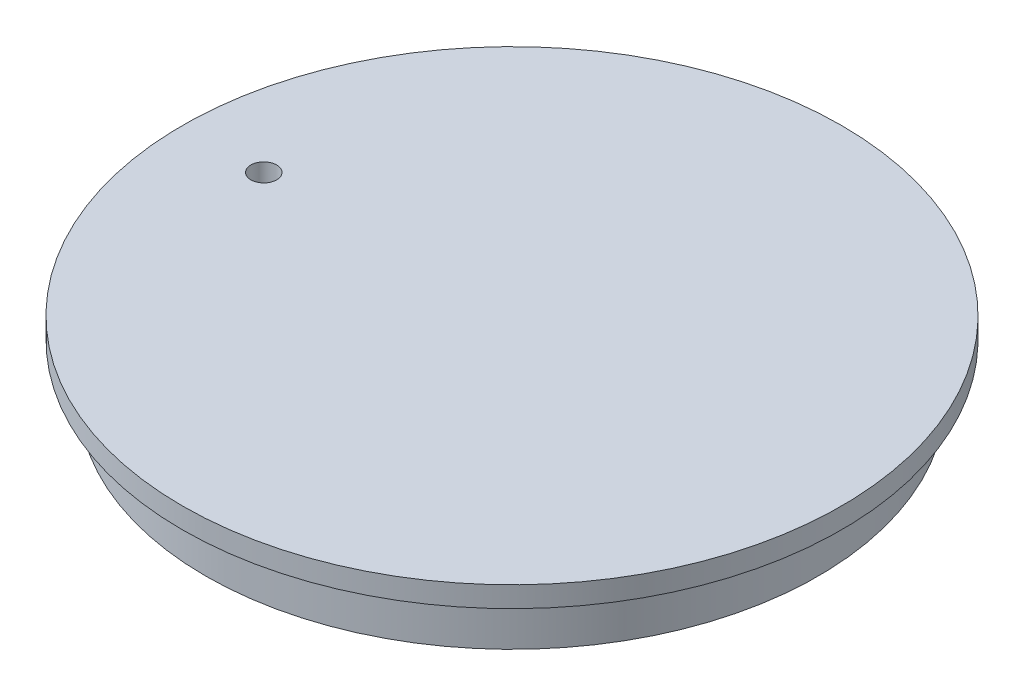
SolidWorks part; units mm, degrees
ref_plane "Front Plane" through (0, 0, 0) normal (0, 0, 1) x (1, 0, 0)
ref_plane "Top Plane" through (0, 0, 0) normal (0, 1, 0) x (1, 0, 0)
ref_plane "Right Plane" through (0, 0, 0) normal (1, 0, 0) x (0, 0, -1)
sketch "Esquisse1" plane through (0, 0, 0) normal (0, 0, 1) x (1, 0, 0)
  line L0 (0, 0) -> (-25.5, 0)
  line L1 (-25.5, 0) -> (-25.5, -1.6)
  line L2 (-25.5, -1.6) -> (-23.7, -1.6)
  line L3 (-23.7, -1.6) -> (-23.7, -5.6)
  line L4 (-23.7, -5.6) -> (-22.1, -5.6)
  line L5 (-22.1, -5.6) -> (-21.3947, -1.6)
  line L6 (-21.3947, -1.6) -> (0, -1.6)
  line L7 (0, -1.6) -> (0, 0)
  dimension "D1" = 25.5
  dimension "D2" = 23.7
  dimension "D3" = 4
  dimension "D4" = 1.6
  dimension "D5" = 1.6
  dimension "D6" = 80
revolve "Révolution1" add sketch "Esquisse1" angle 360 about L7
sketch "Esquisse2" plane through (0, 0, 0) normal (0, 1, 0) x (1, 0, 0)
  circle A0 centre (-19.2065, 0) radius 1
  dimension "D1" = 2
extrude "Enlèv. mat.-Extru.1" cut sketch "Esquisse2" against normal through all
